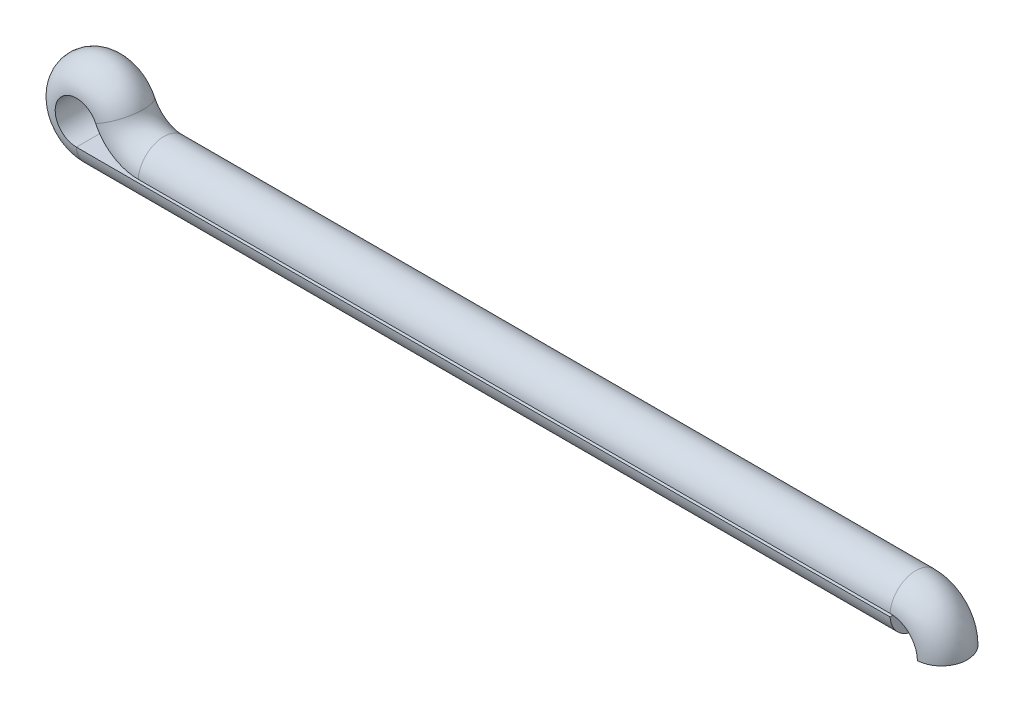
SolidWorks part; units mm, degrees
ref_plane "Front Plane" through (0, 0, 0) normal (0, 0, 1) x (1, 0, 0)
ref_plane "Top Plane" through (0, 0, 0) normal (0, 1, 0) x (1, 0, 0)
ref_plane "Right Plane" through (0, 0, 0) normal (1, 0, 0) x (0, 0, -1)
sketch "PathSke" plane through (0, 0, 0) normal (0, 0, 1) x (1, 0, 0)
  line L0 (12.6017, 0) -> (0, 0) construction
  line L1 (0, 0) -> (0, 3.73) construction
  line L2 (0, -0.4742) -> (0, 0.4742) construction
  line L3 (12.6017, -0.4318) -> (-1.0361, -0.4318)
  line L4 (0, 0.4318) -> (12.6017, 0.4318)
  line L5 (-1.7981, 0.3302) -> (-1.7981, 3.73) construction
  arc A0 (12.6017, 0.4318) -> (13.4653, -0.4318) centre (12.6017, -0.4318) cw
  arc A1 (-1.0361, -0.4318) -> (-0.3454, 0.6519) centre (-1.0361, 0.3302) cw
  arc A2 (-0.3454, 0.6519) -> (0, 0.4318) centre (0, 0.8128) ccw
ref_plane "Plane1" through (0, -0.4318, 0) normal (0, 1, 0) x (1, 0, 0)
sketch "Sketch2" plane through (0, -0.4318, 0) normal (0, 1, 0) x (1, 0, 0)
  line L0 (13.0589, 0.4311) -> (13.0589, -0.4311)
  arc A0 (13.0589, -0.4311) -> (13.0589, 0.4311) centre (13.0335, 0) ccw
  point P4 (13.4653, 0)
sweep "Sweep1" add profiles "Sketch2" path "PathSke"
equation "\"D1@Sketch2\"=\"Diameter@PathSke\""
